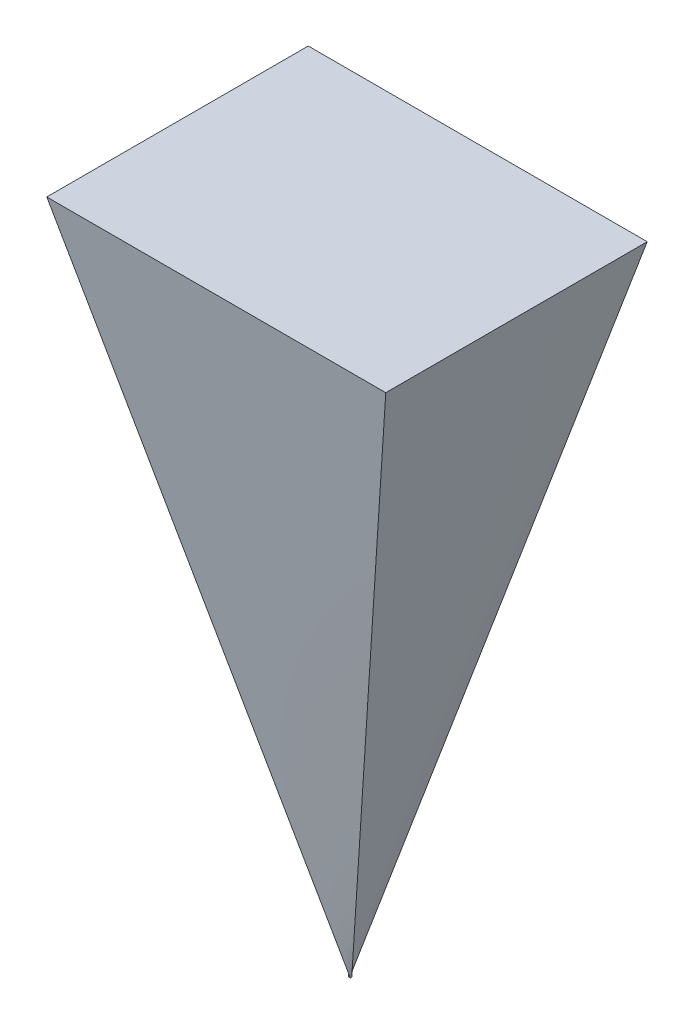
SolidWorks part; units mm, degrees
ref_plane "Front Plane" through (0, 0, 0) normal (0, 0, 1) x (1, 0, 0)
ref_plane "Top Plane" through (0, 0, 0) normal (0, 1, 0) x (1, 0, 0)
ref_plane "Right Plane" through (0, 0, 0) normal (1, 0, 0) x (0, 0, -1)
ref_plane "Plane1" through (0, 2489.2, 0) normal (0, 1, 0) x (-1, 0, 0)
ref_plane "Plane2" through (0, 4978.4, 0) normal (0, 1, 0) x (-1, 0, 0)
sketch "Sketch1" plane through (0, 0, 0) normal (0, 1, 0) x (1, 0, 0)
  line L1 (-6.477, 5.3086) -> (6.477, 5.3086)
  line L2 (-6.477, 5.3086) -> (-6.477, -5.334)
  line L3 (-6.477, -5.334) -> (6.477, -5.334)
  line L4 (6.477, 5.3086) -> (6.477, -5.334)
  dimension "D1" = 10.6426
  dimension "D2" = 12.954
  dimension "D3" = 5.334
  dimension "D4" = 6.477
sketch "Sketch2" plane through (0, 2489.2, 0) normal (0, 1, 0) x (-1, 0, 0)
  line L1 (-1468.12, 1181.1) -> (1452.88, 1181.1)
  line L2 (-1468.12, 1181.1) -> (-1468.12, -1168.4)
  line L3 (-1468.12, -1168.4) -> (1452.88, -1168.4)
  line L4 (1452.88, 1181.1) -> (1452.88, -1168.4)
  dimension "D1" = 2349.5
  dimension "D2" = 2921
  dimension "D3" = 1468.12
  dimension "D4" = 1168.4
sketch "Sketch5" plane through (0, 4978.4, 0) normal (0, 1, 0) x (-1, 0, 0)
  line L1 (-1282.7, 1013.46) -> (1282.7, 1013.46)
  line L2 (-1282.7, 1013.46) -> (-1282.7, -965.2)
  line L3 (-1282.7, -965.2) -> (1282.7, -965.2)
  line L4 (1282.7, 1013.46) -> (1282.7, -965.2)
  dimension "D1" = 2565.4
  dimension "D2" = 1978.66
  dimension "D3" = 965.2
  dimension "D4" = 1282.7
loft "Loft7" add profiles "Sketch1", "Sketch5"
